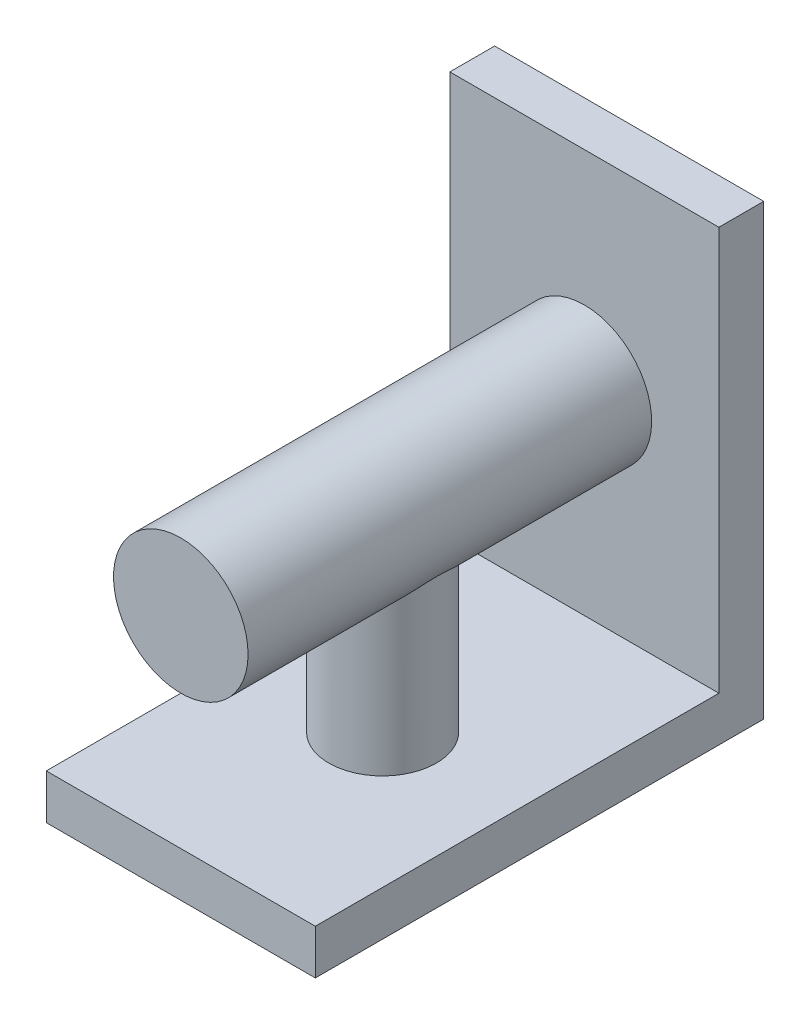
SolidWorks part; units mm, degrees
ref_plane "Front Plane" through (0, 0, 0) normal (0, 0, 1) x (1, 0, 0)
ref_plane "Top Plane" through (0, 0, 0) normal (0, 1, 0) x (1, 0, 0)
ref_plane "Right Plane" through (0, 0, 0) normal (1, 0, 0) x (0, 0, -1)
sketch "Sketch1" plane through (0, 0, 0) normal (1, 0, 0) x (0, 0, -1)
  line L0 (0, 0) -> (50, 0)
  line L1 (50, 0) -> (50, 50)
  line L2 (50, 50) -> (45, 50)
  line L3 (45, 50) -> (45, 5)
  line L4 (45, 5) -> (0, 5)
  line L5 (0, 5) -> (0, 0)
  dimension "D1" = 50
  dimension "D2" = 50
  dimension "D3" = 5
extrude "Extrude1" add sketch "Sketch1" along normal mid plane 30
sketch "Sketch2" plane through (0, 0, -45) normal (0, 0, 1) x (1, 0, 0)
  line L0 (0, 50) -> (0, 5) construction
  line L1 (15, 50) -> (-15, 50) construction
  line L2 (15, 5) -> (-15, 5) construction
  circle A0 centre (0, 27.5) radius 7.5
  dimension "D1" = 15
extrude "Extrude2" add sketch "Sketch2" along normal through all
sketch "Sketch3" plane through (0, 5, 0) normal (0, 1, 0) x (-1, 0, 0)
  line L0 (-15, -22.5) -> (15, -22.5) construction
  line L1 (-15, -45) -> (-15, 0) construction
  line L2 (15, -45) -> (15, 0) construction
  circle A0 centre (0, -22.5) radius 6
  dimension "D1" = 12
extrude "Extrude3" add sketch "Sketch3" along normal up to next
